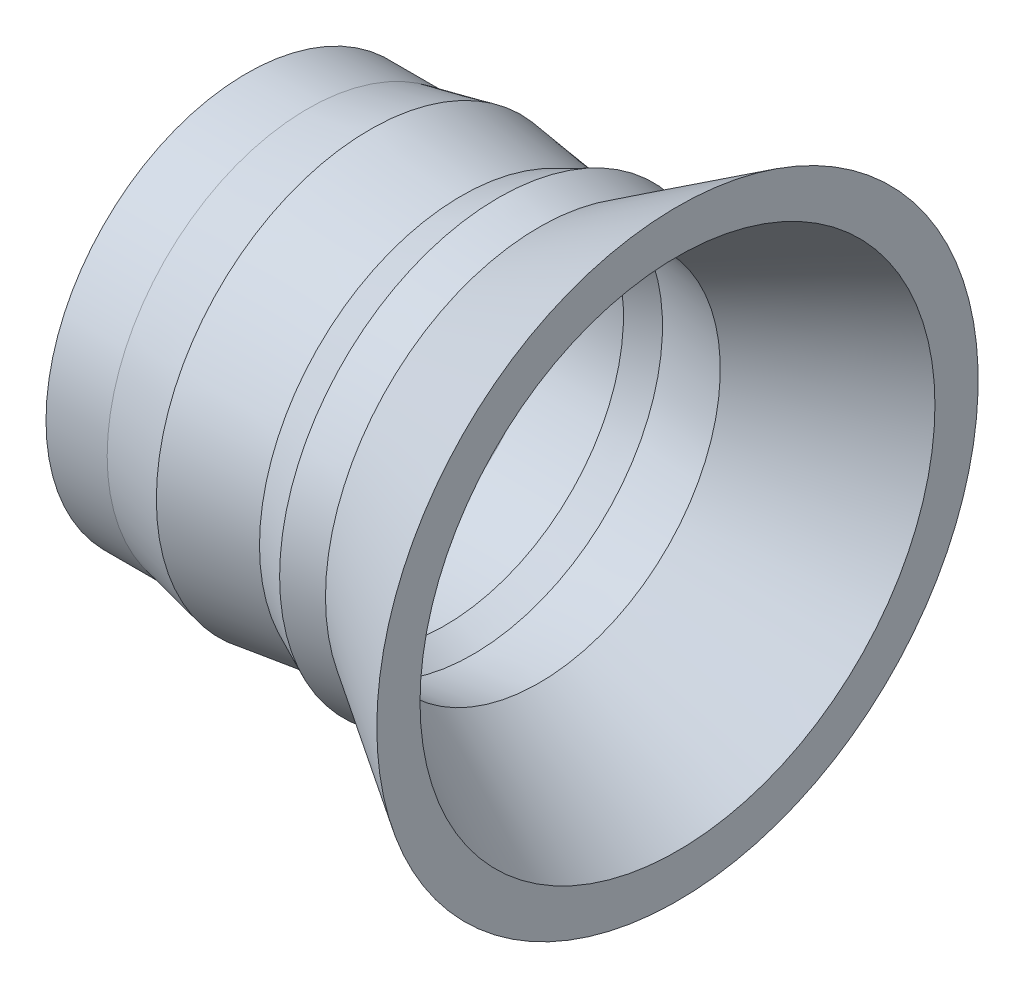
SolidWorks part; units mm, degrees
ref_plane "Front Plane" through (0, 0, 0) normal (0, 0, 1) x (1, 0, 0)
ref_plane "Top Plane" through (0, 0, 0) normal (0, 1, 0) x (1, 0, 0)
ref_plane "Right Plane" through (0, 0, 0) normal (1, 0, 0) x (0, 0, -1)
sketch "Sketch1" plane through (0, 0, 0) normal (0, 0, 1) x (1, 0, 0)
  line L0 (0, 0) -> (109.2236, 0) construction
  line L1 (0, 0) -> (0, 50.8) construction
  line L2 (0, 50.8) -> (15.503, 50.8)
  line L3 (15.503, 50.8) -> (31.2828, 54.1221)
  line L4 (31.2828, 54.1221) -> (54.4545, 51.1552)
  line L5 (54.4545, 51.1552) -> (63.8379, 55.4415)
  line L6 (63.8379, 55.4415) -> (74.1425, 54.1221)
  line L7 (74.1425, 54.1221) -> (109.2236, 76.2)
  line L8 (0, 50.8) -> (0, 48.082)
  line L9 (0, 48.082) -> (18.1089, 48.082)
  line L10 (18.1089, 48.082) -> (31.2828, 45.3136)
  line L11 (31.2828, 45.3136) -> (50.2222, 45.3136)
  line L12 (50.2222, 45.3136) -> (57.3426, 48.082)
  line L13 (57.3426, 48.082) -> (74.1425, 45.9309)
  line L14 (74.1425, 45.9309) -> (109.2236, 65.246)
  line L15 (109.2236, 76.2) -> (109.2236, 65.246)
  line L16 (109.2236, 76.2) -> (109.2236, 0) construction
  point P9 (95.9007, 0)
  point P18 (96.7006, 65.246)
  point P19 (60.9495, 49.5624)
  point P20 (31.2828, 50.8)
  point P21 (96.9243, 65.246)
  point P22 (0, 0)
  point P23 (109.2236, 0)
  point P24 (109.4473, 65.246)
  point P25 (74.1425, 54.1221)
  point P26 (109.2236, 65.246)
  point P27 (57.3426, 48.082)
  point P28 (0, 0)
  point P29 (31.2828, 45.3136)
  dimension "D1" = 50.8
  dimension "D2" = 76.2
  dimension "D3" = 10.954
  dimension "D4" = 109.2236
revolve "Revolve1" add sketch "Sketch1" angle 360 about L0
